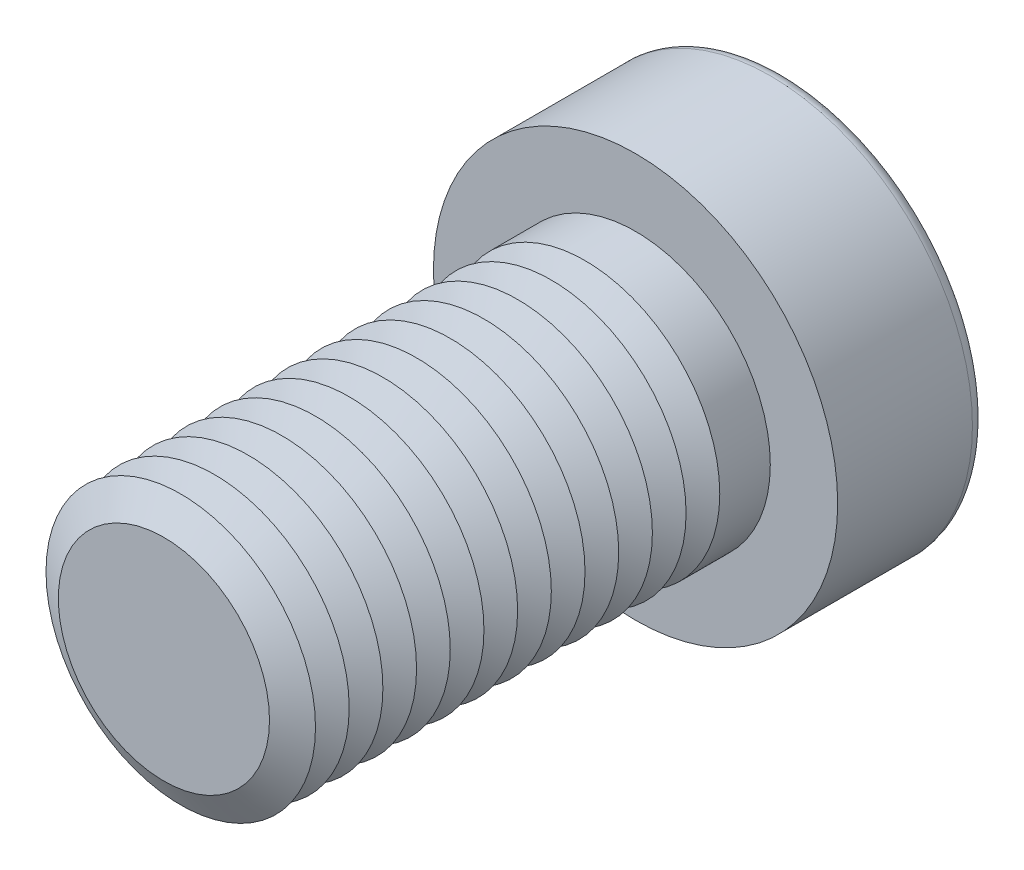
SolidWorks part; units mm, degrees
ref_plane "Front Plane" through (0, 0, 0) normal (0, 0, 1) x (1, 0, 0)
ref_plane "Top Plane" through (0, 0, 0) normal (0, 1, 0) x (1, 0, 0)
ref_plane "Right Plane" through (0, 0, 0) normal (1, 0, 0) x (0, 0, -1)
sketch "Sketch1" plane through (0, 0, 0) normal (0, 0, 1) x (1, 0, 0)
  circle A0 centre (0, 0) radius 10
  dimension "D1" = 20
extrude "Boss-Extrude1" add sketch "Sketch1" along normal blind 35
sketch "Sketch2" plane through (0, 0, 0) normal (0, 0, -1) x (-1, 0, 0)
  circle A0 centre (0, 0) radius 15
  dimension "D1" = 30
extrude "Boss-Extrude2" add sketch "Sketch2" along normal blind 11
sketch "Sketch3" plane through (0, 0, -11) normal (0, 0, -1) x (-1, 0, 0)
  line L1 (-4.0415, 7) -> (-8.0829, 0)
  line L2 (-8.0829, 0) -> (-4.0415, -7)
  line L3 (-4.0415, -7) -> (4.0415, -7)
  line L4 (4.0415, -7) -> (8.0829, 0)
  line L5 (8.0829, 0) -> (4.0415, 7)
  line L6 (4.0415, 7) -> (-4.0415, 7)
  circle A0 centre (0, 0) radius 7 construction
  dimension "D1" = 14
extrude "Cut-Extrude1" cut sketch "Sketch3" against normal blind 10.5
fillet "Fillet1" radius 1 1 edges at (-15, 0, -11)
sketch "Sketch4" plane through (0, 0, -0.5) normal (0, 0, -1) x (-1, 0, 0)
  line L0 (4.0415, -7) -> (8.0829, 0) construction
  circle A0 centre (0, 0) radius 7
extrude "Cut-Extrude2" cut sketch "Sketch4" against normal through all draft 60
sketch "Sketch5" plane through (0, 0, -11) normal (0, 0, -1) x (-1, 0, 0)
  circle A0 centre (0, 0) radius 8.0829
extrude "Cut-Extrude3" cut sketch "Sketch5" against normal through all draft 75
sketch "Sketch7" plane through (0, 0, 0) normal (1, 0, 0) x (0, 0, -1)
  line L25 (-35, 7.8349) -> (-33.75, 10)
  line L26 (-35, 10) -> (-35, -10) construction
  line L27 (-33.75, 10) -> (-36.25, 10)
  line L28 (-36.25, 10) -> (-35, 7.8349)
  line L29 (0, 10) -> (-35, 10) construction
  dimension "D1" = 2.5
revolve "Cut-Revolve1" cut sketch "Sketch7" angle 360 about axis through (0, 0, 35) along (0, 0, -1)
pattern_linear "LPattern1" count 13 spacing 2.5 along (0, 0, -1) of "Cut-Revolve1"
